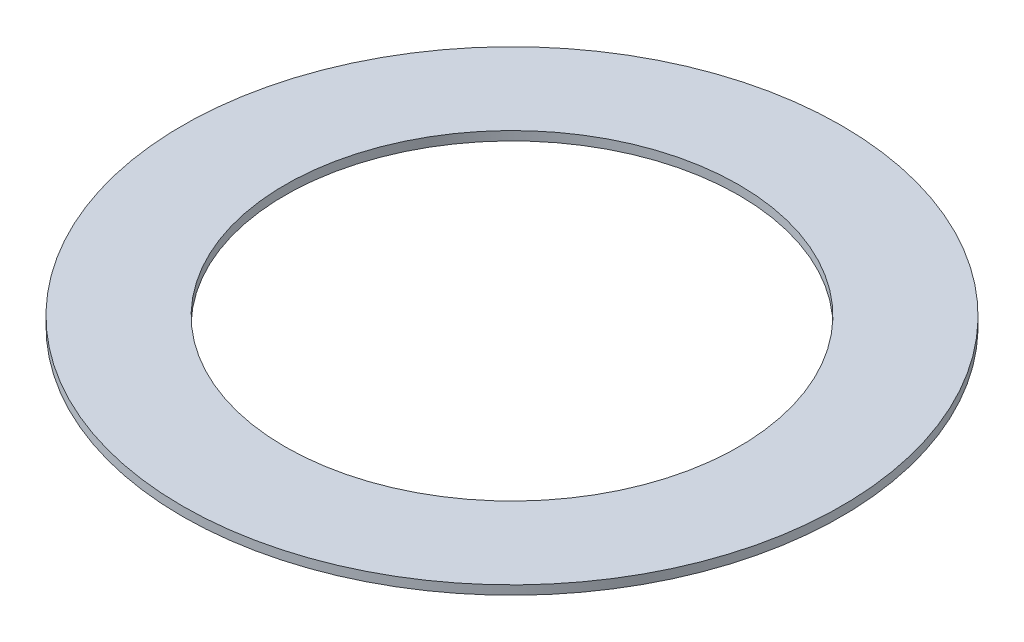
SolidWorks part; units mm, degrees
ref_plane "Front Plane" through (0, 0, 0) normal (0, 0, 1) x (1, 0, 0)
ref_plane "Top Plane" through (0, 0, 0) normal (0, 1, 0) x (1, 0, 0)
ref_plane "Right Plane" through (0, 0, 0) normal (1, 0, 0) x (0, 0, -1)
sketch "Sketch1" plane through (0, 0, 0) normal (0, 1, 0) x (1, 0, 0)
  circle A0 centre (0, 0) radius 3.2004
  circle A1 centre (0, 0) radius 4.6482
  dimension "D1" = 6.4008
  dimension "D2" = 9.2964
extrude "Extrude1" add sketch "Sketch1" along normal blind 0.127
